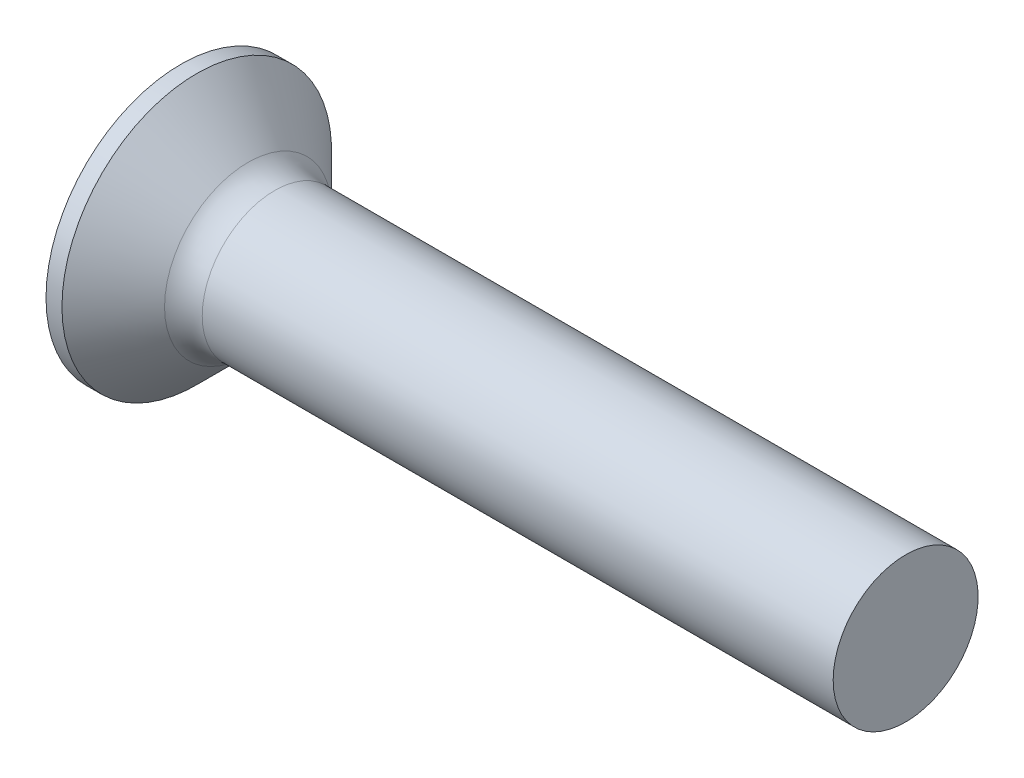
SolidWorks part; units mm, degrees
revolve "Base-Revolve" add sketch "BodySke"
sketch "BodySke" plane through (0, 0, 0) normal (0, 0, 1) x (1, 0, 0)
  line L0 (0, 0) -> (0, 4.65)
  line L1 (0, 4.65) -> (0.55, 4.65)
  line L2 (2.7, 2.5) -> (25, 2.5)
  line L3 (25, 2.5) -> (25, 0)
  line L4 (25, 0) -> (0, 0)
  line L5 (-6.35, 0) -> (82.55, 0) construction
  line L6 (2.7, -2.5) -> (25, -2.5) construction
  line L7 (0.55, -4.65) -> (2.7, -2.5) construction
  line L8 (0.55, 4.65) -> (2.7, 2.5)
  line L9 (0, -4.65) -> (0.55, -4.65) construction
  line L10 (3.5, 4.0875) -> (3.5, -5.4375) construction
  line L11 (0, 6.35) -> (0, -3.175) construction
fillet "Fillet1" radius 1.3 1 edges at (2.7, 0, 2.5)
ref_plane "Plane1" through (0, 0, 0) normal (0, 0, 1) x (1, 0, 0)
ref_plane "Plane2" through (0, 0, 0) normal (0, 1, 0) x (1, 0, 0)
ref_plane "Plane3" through (0, 0, 0) normal (1, 0, 0) x (0, 0, -1)
sketch "Sketch3" plane through (0, 0, 0) normal (-1, 0, 0) x (0, 0, 1)
  line L0 (-0.515, 2.45) -> (0.515, 2.45)
  line L1 (0.515, 2.45) -> (0.515, -2.45)
  line L2 (0.515, -2.45) -> (-0.515, -2.45)
  line L3 (-0.515, -2.45) -> (-0.515, 2.45)
ref_plane "Plane4" through (3.05, 0, 0) normal (-1, 0, 0) x (0, 0, 1)
sketch "Sketch4" plane through (3.05, 0, 0) normal (-1, 0, 0) x (0, 0, 1)
  line L0 (-0.515, 0.9293) -> (0.515, 0.9293)
  line L3 (0.515, 0.9293) -> (0.515, -0.9293)
  line L4 (0.515, -0.9293) -> (-0.515, -0.9293)
  line L5 (-0.515, -0.9293) -> (-0.515, 0.9293)
loft "Recess" cut profiles "Sketch3", "Sketch4"
pattern_circular "RecPat" count 2 every 90 about axis through (0, 0, 0) along (1, 0, 0) of "Recess"
sketch "RecCorSke" plane through (0, 0, 0) normal (0, 0, 1) x (1, 0, 0)
  line L0 (-3.175, 0) -> (15.875, 0) construction
  line L2 (0, 0) -> (0, 1.0643)
  line L3 (0, 1.0643) -> (3.05, 0.851)
  line L4 (3.05, 0.851) -> (3.3265, 0)
  line L5 (3.3265, 0) -> (0, 0)
revolve "RecessCore" cut sketch "RecCorSke" angle 360 about L0
sketch "ThdSchSke" plane through (0, 0, 0) normal (0, 0, 1) x (1, 0, 0)
  line L0 (3.5, -2.055) -> (3.1884, -2.5)
  line L1 (3.5, -2.055) -> (3.8116, -2.5)
  line L2 (3.8116, -2.5) -> (3.8116, -3.125)
  line L3 (-3.175, 0) -> (5.1513, 0) construction
  line L5 (3.8116, -3.125) -> (3.1884, -3.125)
  line L6 (3.1884, -3.125) -> (3.1884, -2.5)
  line L7 (0, 4.65) -> (0, -4.65) construction
revolve "ThreadSchematic" [suppressed] cut sketch "ThdSchSke" angle 360 about L3
pattern_linear "ThdSchPat" [suppressed]
equation "\"D1@Sketch3\" = \"Cross_dia@Sketch3\" / 2"
equation "\"D2@Sketch3\" = \"Cross_width@Sketch3\" / 2"
equation "\"Depth@RecCorSke\" = \"Cross_depth@Plane4\""
equation "\"D1@Sketch4\" = \"Cross_width@Sketch3\""
equation "\"D2@Sketch4\" = \"Cross_dia@Sketch3\" - 2.0 * \"Cross_depth@Plane4\" * tan(26.5  * 0.017453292)"
equation "\"D3@Sketch4\" = \"D1@Sketch4\" / 2"
equation "\"D4@Sketch4\" = \"D2@Sketch4\" / 2"
equation "\"Thread_length@ThreadCosmetic\" = ((sgn( (\"Length@BodySke\" - \"Advance@BodySke\" * 1.0 - \"Head_ht@BodySke\" ) - \"Thread_nom@BodySke\" )-1)*( (\"Length@BodySke\" - \"Advance@BodySke\" * 1.0 - \"Head_ht@BodySke\" "
equation "\"Thread_minor@ThdSchSke\" = \"Thread_minor@ThreadCosmetic\""
equation "\"Diameter@ThdSchSke\" = \"Diameter@BodySke\""
equation "\"Overcut@ThdSchSke\" = \"Diameter@BodySke\" * 1.25"
equation "\"Start@ThdSchSke\" = 0.000001 + \"Length@BodySke\" - \"Thread_length@ThreadCosmetic\"  '---Countersunk---"
equation "\"Num_threads@ThdSchPat\" = int( \"Thread_length@ThreadCosmetic\" / \"Advance@BodySke\" + 0.999 )  + 1"
equation "\"Advance@ThdSchPat\" = \"Thread_length@ThreadCosmetic\" /  (\"Num_threads@ThdSchPat\" - 1) 'relax it"
